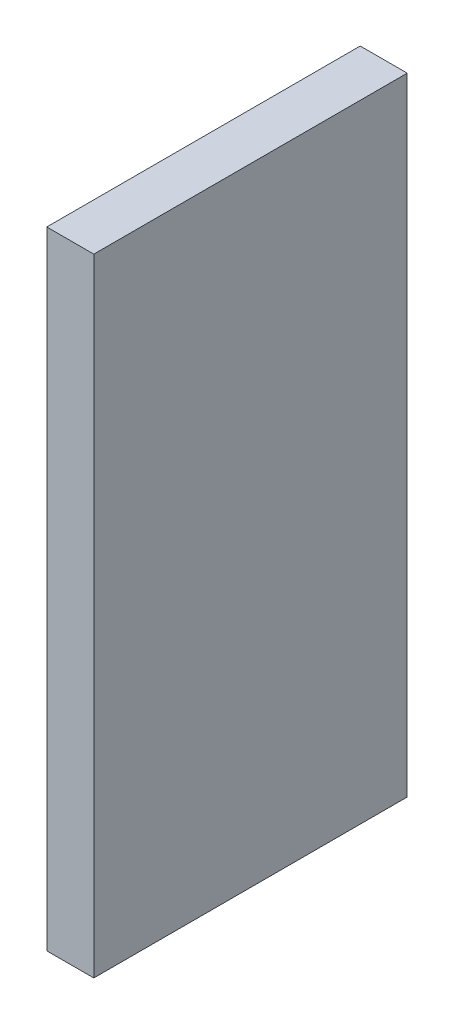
SolidWorks part; units mm, degrees
ref_plane "Front Plane" through (0, 0, 0) normal (0, 0, 1) x (1, 0, 0)
ref_plane "Top Plane" through (0, 0, 0) normal (0, 1, 0) x (1, 0, 0)
ref_plane "Right Plane" through (0, 0, 0) normal (1, 0, 0) x (0, 0, -1)
sketch "Sketch1" plane through (0, 0, 0) normal (0, 0, 1) x (1, 0, 0)
  line L1 (14.5217, -32.2661) -> (16.0217, -32.2661)
  line L2 (14.5217, -32.2661) -> (14.5217, -52.2661)
  line L3 (14.5217, -52.2661) -> (16.0217, -52.2661)
  line L4 (16.0217, -32.2661) -> (16.0217, -52.2661)
  dimension "D1" = 1.5
extrude "Extrude1" add sketch "Sketch1" against normal up to surface (10 mm away)
